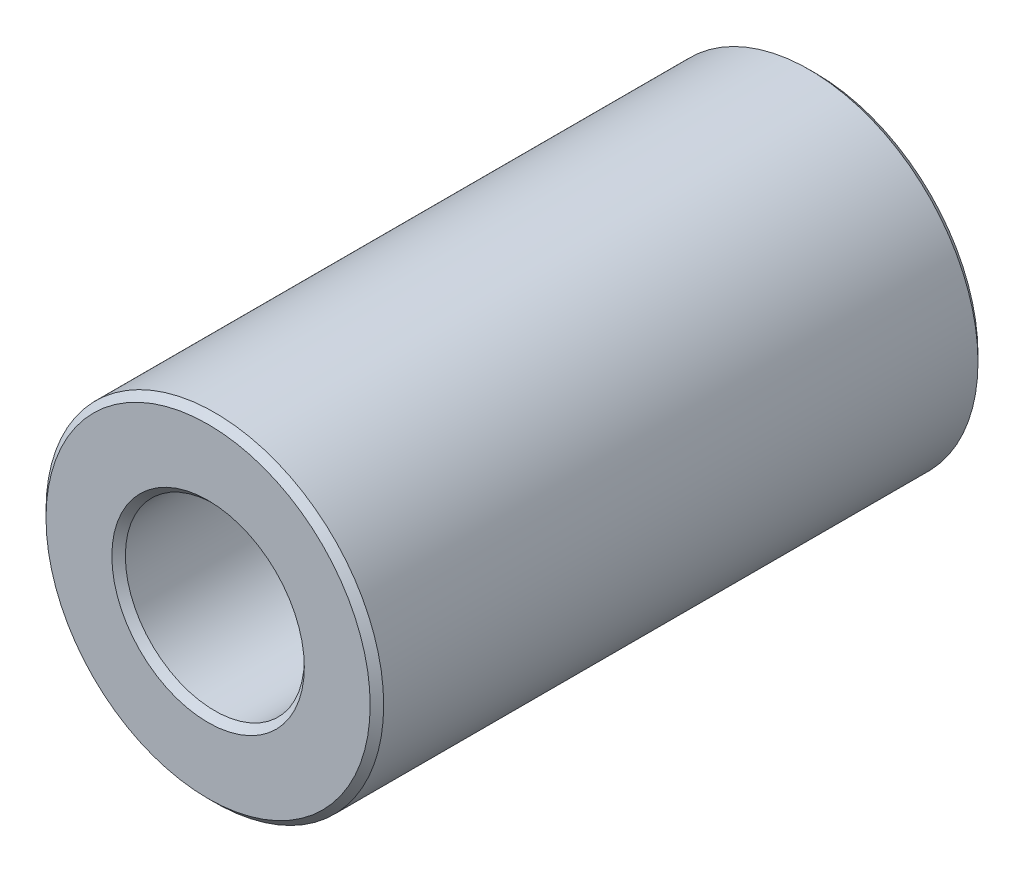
SolidWorks part; units mm, degrees
ref_plane "Front Plane" through (0, 0, 0) normal (0, 0, 1) x (1, 0, 0)
ref_plane "Top Plane" through (0, 0, 0) normal (0, 1, 0) x (1, 0, 0)
ref_plane "Right Plane" through (0, 0, 0) normal (1, 0, 0) x (0, 0, -1)
sketch "Sketch1" plane through (0, 0, 0) normal (0, 0, 1) x (1, 0, 0)
  circle A0 centre (0, 0) radius 5
  circle A1 centre (0, 0) radius 2.65
  dimension "D1" = 10
  dimension "D2" = 5.3
extrude "Boss-Extrude2" add sketch "Sketch1" along normal mid plane 18
chamfer "Chamfer3" distance 0.2 angle 45 4 edges at (5, 0, 9) (5, 0, -9) (2.65, 0, -9) (2.65, 0, 9)
